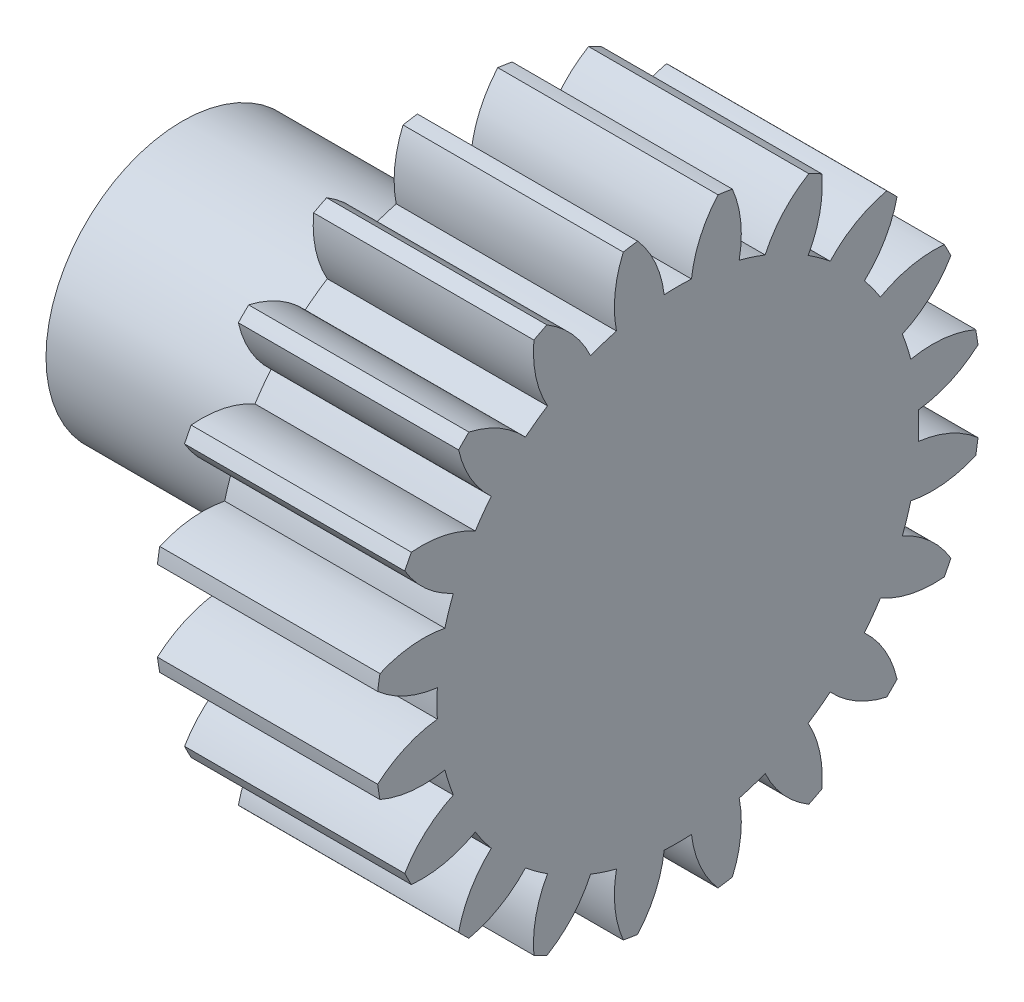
SolidWorks part; units mm, degrees
ref_plane "Plane1" through (0, 0, 0) normal (0, 0, 1) x (1, 0, 0)
ref_plane "Plane2" through (0, 0, 0) normal (0, 1, 0) x (1, 0, 0)
ref_plane "Plane3" through (0, 0, 0) normal (1, 0, 0) x (0, 0, -1)
other "Configuration Table"
sketch "HoldingSke" plane through (0, 0, 0) normal (0, 1, 0) x (1, 0, 0)
  line L0 (0, 0) -> (0.3759, -0.1368)
  line L1 (-15, 0) -> (100, 0) construction
  line L2 (0, 0) -> (-2.1039, 2.3779)
  line L3 (0, 0) -> (-11.863, 4.5341)
  line L4 (0, 0) -> (8.1152, 2.9537)
  line L5 (0, 0) -> (-14.0543, -5.2418)
  line L6 (0, 0) -> (-16.5793, -11.1861)
  line L7 (-2.1039, 2.3779) -> (2.2011, 21.9091)
  line L8 (-76.2, 54.61) -> (-74.4, 54.61)
  line L9 (-71.009, 38.7566) -> (-53.1078, 45.2721)
  line L10 (-76.2, 71.12) -> (104.1128, 71.12)
  line L11 (0, 0) -> (-20, 0)
  line L12 (-76.2, 101.6) -> (-76.113, 101.6)
  line L13 (24.9733, 27.94) -> (52.9518, 28.4284)
  line L14 (24.9733, 27.94) -> (24.9743, 27.94)
  line L15 (24.9733, 27.94) -> (100.4006, 29.5858)
  line L16 (-63.627, -2.5) -> (-12.827, -2.5)
  circle A0 centre (0, 0) radius 5
  circle A1 centre (0, 0) radius 10
  circle A2 centre (0, 0) radius 10
  circle A3 centre (0, 0) radius 5
sketch "BasProSke" plane through (0, 0, 0) normal (0, 1, 0) x (1, 0, 0)
  line L0 (-10, 0) -> (60, 0) construction
  line L1 (0, 0) -> (0, 27.5)
  line L2 (0, 0) -> (20, 0)
  line L3 (20, 0) -> (20, 27.5)
  line L4 (20, 27.5) -> (0, 27.5)
revolve "Base-Revolve" add sketch "BasProSke" angle 360 about L0
sketch "TooCutSke" plane through (0, 0, 0) normal (1, 0, 0) x (0, 0, -1)
  line L1 (0, 0) -> (0, 107) construction
  line L2 (0, 0) -> (-2.1137, 24.9105) construction
  line L3 (0, 0) -> (-7.8012, 49.2549) construction
  line L4 (-2.1137, 24.9105) -> (-3.9006, 24.6275) construction
  arc A0 (1.2377, 21.839) -> (-1.2377, 21.839) centre (0, 0) ccw
  arc A1 (3.6672, 27.28) -> (-3.6672, 27.28) centre (0, 0) ccw
  circle A2 centre (0, 0) radius 25 construction
  circle A3 centre (0, 0) radius 23.4923 construction
  arc A4 (-1.2377, 21.839) -> (-3.6672, 27.28) centre (-11.1689, 20.6675) ccw
  arc A5 (3.6672, 27.28) -> (1.2377, 21.839) centre (11.1689, 20.6675) ccw
extrude "ToothCut" cut sketch "TooCutSke" along normal through all
fillet "Breaks" [suppressed] radius 0.05
fillet "RootFillets" [suppressed] radius 0.626
pattern_circular "TeethCuts" count 20 every 18 about axis through (-10, 0, 0) along (1, 0, 0) of "ToothCut", "RootFillets", "Breaks"
scale "Scale1" scale about centroid uniform scaling yes scale factor 0.6
sketch "HubNeaOneSke" plane through (4, 0, 0) normal (-1, 0, 0) x (0, 0, 1)
  circle A0 centre (0, 0) radius 10
extrude "HubNearOne" [suppressed] add sketch "HubNeaOneSke" along normal blind 3.0001
sketch "HubNeaBotSke" plane through (4, 0, 0) normal (-1, 0, 0) x (0, 0, 1)
  circle A0 centre (0, 0) radius 10
extrude "HubNearBoth" [suppressed] add sketch "HubNeaBotSke" along normal blind 1.5
ref_plane "FarPln" through (20, 0, 0) normal (1, 0, 0) x (0, 0, -1)
sketch "HubFarSke" plane through (20, 0, 0) normal (1, 0, 0) x (0, 0, -1)
  circle A0 centre (0, 0) radius 10
extrude "HubFar" [suppressed] add sketch "HubFarSke" along normal blind 1.5
sketch "BorSke" plane through (0, 0, 0) normal (1, 0, 0) x (0, 0, -1)
  circle A0 centre (0, 0) radius 5
extrude "Bore" [suppressed] cut sketch "BorSke" along normal mid plane 40.0001
sketch "KeySke" plane through (0, 0, 0) normal (1, 0, 0) x (0, 0, -1)
  line L0 (-2, 0) -> (-2, 6.8)
  line L1 (-2, 6.8) -> (2, 6.8)
  line L2 (2, 6.8) -> (2, 0)
  line L3 (0, 0) -> (0, 34) construction
  line L4 (-2, 0) -> (2, 0)
extrude "Keyway" [suppressed] cut sketch "KeySke" along normal mid plane 40.0001
pattern_circular "Keyway2" [suppressed] count 2 every 90 about axis through (-10, 0, 0) along (1, 0, 0)
sketch "Sketch2" plane through (4, 0, 0) normal (-1, 0, 0) x (0, 0, 1)
  circle A0 centre (0, 0) radius 7.425
  dimension "D1" = 14.85
extrude "Boss-Extrude1" add sketch "Sketch2" along normal blind 15
sketch "Sketch3" plane through (-11, 0, 0) normal (-1, 0, 0) x (0, 0, 1)
  circle A2 centre (0, 0) radius 5.425
  circle A3 centre (0, 0) radius 5.425
  dimension "D1" = 2
extrude "Cut-Extrude1" cut sketch "Sketch3" against normal up to surface (15 mm away)
equation "' \"Module@HoldingSke\" = 6.35"
equation "' \"Num_teeth@HoldingSke\" = 12"
equation "' \"Ap@HoldingSke\" =  20"
equation "' \"Ap@HoldingSke\" = 20"
equation "' \"Width@HoldingSke\" = 0.5 * 25.4"
equation "' \"Hub_dia@HoldingSke\"= 1 * 25.4"
equation "' \"Hub_dia@HoldingSke\" = 1 * 25.4"
equation "' \"Overall_len@HoldingSke\" = 1.0 * 25.4"
equation "' \"Bore@HoldingSke\" = 0.75 * 25.4"
equation "' \"T_dim@HoldingSke\" = 0.1 * 25.4"
equation "' \"Width@KeySke\" = 0.25 * 25.4"
equation "' \"Show_teeth@HoldingSke\" = 13"
equation "' \"Backlash@HoldingSke\" = 0.009 * 25.4"
equation "' \"Addendum_fac@HoldingSke\" = 1.0"
equation "' \"Dedendum_fac@HoldingSke\" = 1.25"
equation "' \"Dedendum_add@HoldingSke\" = 0.00005 * 25.4"
equation "' \"Clearance_fac@HoldingSke\" = 0.25"
equation "\"Pitch@HoldingSke\" = 1 / \"Module@HoldingSke\""
equation "\"Overcut_dia@TooCutSke\" = (\"Num_teeth@HoldingSke\" + 2 * \"Addendum_fac@HoldingSke\") / \"Pitch@HoldingSke\" + 0.002 * 25.4"
equation "\"Pitch_dia@TooCutSke\" = \"Num_teeth@HoldingSke\" / \"Pitch@HoldingSke\""
equation "\"Base_dia@TooCutSke\" = \"Num_teeth@HoldingSke\" / \"Pitch@HoldingSke\" * cos((\"Ap@HoldingSke\"  * 3.14159265 / 180))"
equation "\"Root_dia@TooCutSke\" = (\"Num_teeth@HoldingSke\" + 2) / \"Pitch@HoldingSke\" - 2 * (\"Addendum_fac@HoldingSke\" + \"Dedendum_fac@HoldingSke\") / \"Pitch@HoldingSke\" - \"Dedendum_add@HoldingSke\" * 2"
equation "\"Half_ang@TooCutSke\" = 180 / \"Num_teeth@HoldingSke\""
equation "\"Half_CT@TooCutSke\" = \"Num_teeth@HoldingSke\" / \"Pitch@HoldingSke\" * sin((3.14159265 / 2 / \"Num_teeth@HoldingSke\")) / 2 - 7 * \"Backlash@HoldingSke\" / 4"
equation "\"Flank_rad@TooCutSke\" = \"Num_teeth@HoldingSke\" / \"Pitch@HoldingSke\" / 5"
equation "\"Radius@RootFillets\" = \"Clearance_fac@HoldingSke\" / \"Pitch@HoldingSke\" + \"Dedendum_add@HoldingSke\""
equation "\"Break_rad@Breaks\" = 0.02 / \"Pitch@HoldingSke\""
equation "\"Thickness@HoldingSke\" = \"Width@HoldingSke\""
equation "\"OAL@HoldingSke\" = \"Thickness@HoldingSke\""
equation "\"MHD@HoldingSke\" = (\"Num_teeth@HoldingSke\" + 2) / \"Pitch@HoldingSke\" - 2 * (\"Addendum_fac@HoldingSke\" + \"Dedendum_fac@HoldingSke\")  / \"Pitch@HoldingSke\" - \"Dedendum_add@HoldingSke\" * 2"
equation "\"MBD@HoldingSke\" = (\"Num_teeth@HoldingSke\" + 2) / \"Pitch@HoldingSke\" - 2 * (\"Addendum_fac@HoldingSke\" + \"Dedendum_fac@HoldingSke\")  / \"Pitch@HoldingSke\" - \"Dedendum_add@HoldingSke\" * 2 - 0.002 * 25.4"
equation "\"MHD@HoldingSke\" = ((sgn( \"MHD@HoldingSke\" - \"Hub_dia@HoldingSke\" )-1)*( \"MHD@HoldingSke\" - \"Hub_dia@HoldingSke\" ))/-2+ \"Hub_dia@HoldingSke\""
equation "\"MBD@HoldingSke\" = ((sgn( \"MBD@HoldingSke\" - \"Bore@HoldingSke\" )-1)*( \"MBD@HoldingSke\" - \"Bore@HoldingSke\" ))/-2+ \"Bore@HoldingSke\""
equation "\"OAL@HoldingSke\" = ((sgn( \"OAL@HoldingSke\" - \"Overall_len@HoldingSke\" )+1)*( \"OAL@HoldingSke\" - \"Overall_len@HoldingSke\" ))/2 + \"Overall_len@HoldingSke\" + 0.000002 * 25.4"
equation "\"Num_teeth@TeethCuts\" = int( \"Show_teeth@HoldingSke\" ) + 1"
equation "\"Num_teeth@TeethCuts\" = ((sgn( \"Num_teeth@TeethCuts\" - \"Num_teeth@HoldingSke\" )-1)*( \"Num_teeth@TeethCuts\" - \"Num_teeth@HoldingSke\" ))/-2+ \"Num_teeth@HoldingSke\""
equation "\"Num_teeth@TeethCuts\" = ((sgn( \"Num_teeth@TeethCuts\" - 2.0)+1)*( \"Num_teeth@TeethCuts\" - 2.0))/2 +2.0"
equation "\"Angle@TeethCuts\" = 360.0 / \"Num_teeth@HoldingSke\""
equation "\"Diameter@BasProSke\" = (\"Num_teeth@HoldingSke\" + 2 * \"Addendum_fac@HoldingSke\") / \"Pitch@HoldingSke\""
equation "\"Thickness@BasProSke\"  = \"Thickness@HoldingSke\""
equation "' \"Fillet_rad@BasProSke\" =  \"Thickness@HoldingSke\" * 0.05"
equation "' \"Fillet_rad@BasProSke\" = \"Thickness@HoldingSke\" * 0.05"
equation "\"MHD@HoldingSke\" = ((sgn( \"MHD@HoldingSke\" - \"Root_dia@TooCutSke\" )-1)*( \"MHD@HoldingSke\" - \"Root_dia@TooCutSke\" ))/-2+ \"Root_dia@TooCutSke\""
equation "\"Diameter@HubNeaOneSke\" = \"MHD@HoldingSke\""
equation "\"Length@HubNearOne\" = \"OAL@HoldingSke\" - \"Thickness@BasProSke\""
equation "\"Diameter@HubNeaBotSke\" = \"MHD@HoldingSke\""
equation "\"Length@HubNearBoth\" = ( \"OAL@HoldingSke\" - \"Thickness@BasProSke\" ) / 2.0"
equation "\"Thickness@FarPln\" = \"Thickness@BasProSke\""
equation "\"Diameter@HubFarSke\" = \"MHD@HoldingSke\""
equation "\"Length@HubFar\" = ( \"OAL@HoldingSke\" - \"Thickness@BasProSke\" ) / 2.0"
equation "\"Diameter@BorSke\" = \"MBD@HoldingSke\""
equation "\"D1@Bore\" = \"OAL@HoldingSke\" * 2.0"
equation "\"D1@Keyway\" = \"OAL@HoldingSke\" * 2.0"
equation "\"Offset@KeySke\" = \"T_dim@HoldingSke\" + \"MBD@HoldingSke\" / 2.0"
